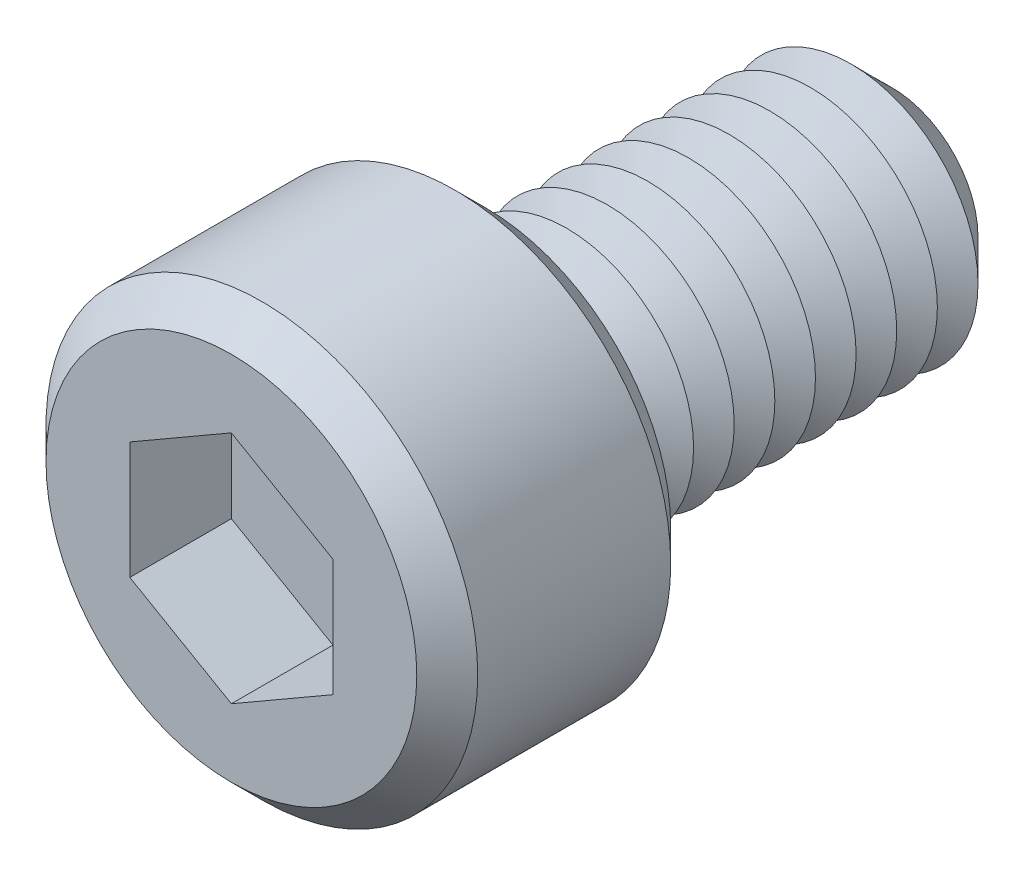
SolidWorks part; units mm, degrees
ref_plane "Front Plane" through (0, 0, 0) normal (0, 0, 1) x (1, 0, 0)
ref_plane "Top Plane" through (0, 0, 0) normal (0, 1, 0) x (1, 0, 0)
ref_plane "Right Plane" through (0, 0, 0) normal (1, 0, 0) x (0, 0, -1)
sketch "Sketch1" plane through (0, 0, 0) normal (0, 0, 1) x (1, 0, 0)
  circle A0 centre (0, 0) radius 4.25
  dimension "D1" = 8.5
extrude "Boss-Extrude1" add sketch "Sketch1" along normal blind 5
sketch "Sketch2" plane through (0, 0, 0) normal (0, 0, -1) x (-1, 0, 0)
  circle A0 centre (0, 0) radius 2.5
  dimension "D1" = 5
extrude "Boss-Extrude2" add sketch "Sketch2" along normal blind 8
chamfer "Chamfer1" distance 0.8 angle 45 1 edges at (-2.5, 0, -8)
sketch "Sketch3" plane through (0, 0, 0) normal (1, 0, 0) x (0, 0, -1)
  line L0 (-2.5121, 0) -> (4.5776, 0) construction
sketch "Sketch4" plane through (0, 0, 0) normal (1, 0, 0) x (0, 0, -1)
  line L0 (0, 2.5) -> (0.4, 1.8072)
  line L1 (0.4, 1.8072) -> (0.8, 2.5)
  line L2 (7.2, 2.5) -> (0, 2.5) construction
  line L3 (0.8, 2.5) -> (0, 2.5)
  dimension "D1" = 0.8
revolve "Cut-Revolve1" cut sketch "Sketch4" angle 360 about L0
pattern_linear "LPattern1" count 9 spacing 0.8 along (0, 0, -1) of "Cut-Revolve1"
sketch "Sketch5" plane through (0, 0, 5) normal (0, 0, 1) x (1, 0, 0)
  line L1 (0, 2.3094) -> (-2, 1.1547)
  line L2 (-2, 1.1547) -> (-2, -1.1547)
  line L3 (-2, -1.1547) -> (0, -2.3094)
  line L4 (0, -2.3094) -> (2, -1.1547)
  line L5 (2, -1.1547) -> (2, 1.1547)
  line L6 (2, 1.1547) -> (0, 2.3094)
  circle A0 centre (0, 0) radius 2 construction
  dimension "D1" = 4
extrude "Cut-Extrude1" cut sketch "Sketch5" against normal blind 2
sketch "Sketch6" plane through (0, 0, 3) normal (0, 0, 1) x (1, 0, 0)
  circle A0 centre (0, 0) radius 0.65
  dimension "D1" = 1.3
extrude "Cut-Extrude2" cut sketch "Sketch6" against normal up to surface (11 mm away)
chamfer "Chamfer2" distance 0.6 angle 45 2 edges at (4.25, 0, 0) (4.25, 0, 5)
